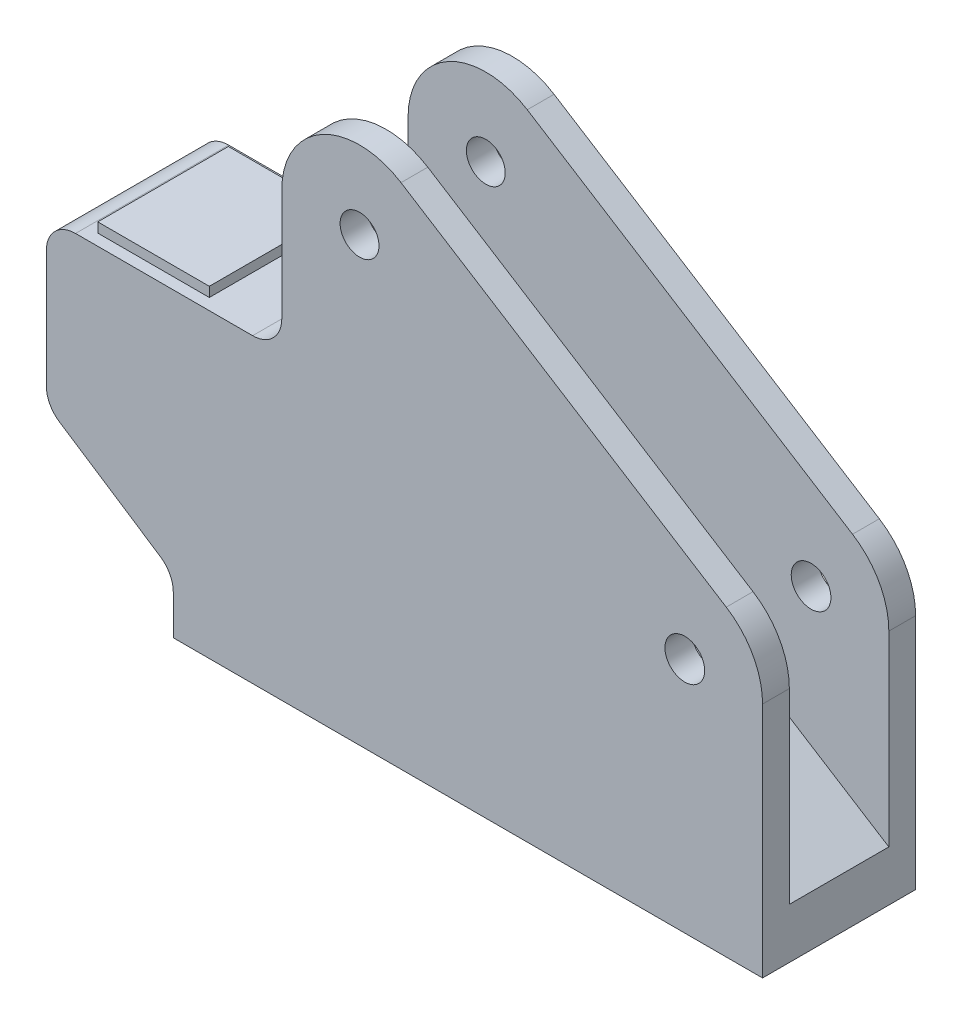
SolidWorks part; units mm, degrees
ref_plane "Front Plane" through (0, 0, 0) normal (0, 0, 1) x (1, 0, 0)
ref_plane "Top Plane" through (0, 0, 0) normal (0, 1, 0) x (1, 0, 0)
ref_plane "Right Plane" through (0, 0, 0) normal (1, 0, 0) x (0, 0, -1)
sketch "Sketch1" plane through (0, 0, 0) normal (0, 0, 1) x (1, 0, 0)
  line L0 (0, 0) -> (1540, 0)
  line L1 (1540, 0) -> (1540, 620)
  line L2 (1445.1422, 791.9076) -> (595.1422, 1327.6076)
  line L3 (283.6, 1155.7) -> (283.6, 863.6)
  line L4 (207.4, 787.4) -> (-255.3835, 787.4)
  line L5 (-331.5835, 711.2) -> (-331.5835, 403.2895)
  line L6 (-297.1549, 339.5589) -> (-34.4286, 167.3583)
  line L7 (0, 103.6277) -> (0, 0)
  arc A0 (1540, 620) -> (1445.1422, 791.9076) centre (1336.8, 620) ccw
  arc A1 (595.1422, 1327.6076) -> (283.6, 1155.7) centre (486.8, 1155.7) ccw
  arc A2 (-34.4286, 167.3583) -> (0, 103.6277) centre (-76.2, 103.6277) cw
  arc A3 (283.6, 863.6) -> (207.4, 787.4) centre (207.4, 863.6) cw
  arc A4 (-331.5835, 403.2895) -> (-297.1549, 339.5589) centre (-255.3835, 403.2895) ccw
  arc A5 (-255.3835, 787.4) -> (-331.5835, 711.2) centre (-255.3835, 711.2) ccw
  circle A6 centre (486.8, 1155.7) radius 50.8
  circle A7 centre (1336.8, 620) radius 51.902
  dimension "D2" = 203.2
  dimension "D3" = 203.2
  dimension "D4" = 76.2
  dimension "D9" = 101.6
  dimension "D10" = 103.804
  dimension "D1" = 1540
  dimension "D5" = 1155.7
  dimension "D6" = 787.4
  dimension "D7" = 620
  dimension "D8" = 850
extrude "Boss-Extrude1" add sketch "Sketch1" along normal blind 400
sketch "Sketch2" plane through (768.0334, 1218.6454, 0) normal (0.5332, 0.846, 0) x (0.846, -0.5332, 0)
  line L0 (800.3634, 0) -> (-204.3627, 0) construction
  line L1 (-642.7469, -70) -> (1708.2165, -70)
  line L2 (-642.7469, -70) -> (-642.7469, -330)
  line L3 (-642.7469, -330) -> (1708.2165, -330)
  line L4 (1708.2165, -70) -> (1708.2165, -330)
  line L5 (800.3634, -400) -> (-204.3627, -400) construction
  dimension "D1" = 70
  dimension "D2" = 70
extrude "Cut-Extrude1" cut sketch "Sketch2" against normal blind 508
sketch "Sketch3" plane through (0, 787.4, 0) normal (0, 1, 0) x (1, 0, 0)
  line L1 (-227.0864, -28.9118) -> (64.408, -28.9118)
  line L2 (-227.0864, -28.9118) -> (-227.0864, -370.1642)
  line L3 (-227.0864, -370.1642) -> (64.408, -370.1642)
  line L4 (64.408, -28.9118) -> (64.408, -370.1642)
extrude "Boss-Extrude2" add sketch "Sketch3" along normal blind 25.4
sketch "Sketch4" plane through (0, 812.8, 0) normal (0, 1, 0) x (1, 0, 0)
  line L0 (595.1422, -330) -> (283.6, -330) construction
  line L1 (1540, -70) -> (-646.1524, -70)
  line L2 (1540, -70) -> (1540, -330)
  line L3 (1540, -330) -> (-646.1524, -330)
  line L4 (-646.1524, -70) -> (-646.1524, -330)
ref_point "Point1"
ref_plane "pivot point" through (486.8, 0, 0) normal (1, 0, 0) x (0, 0, -1)
